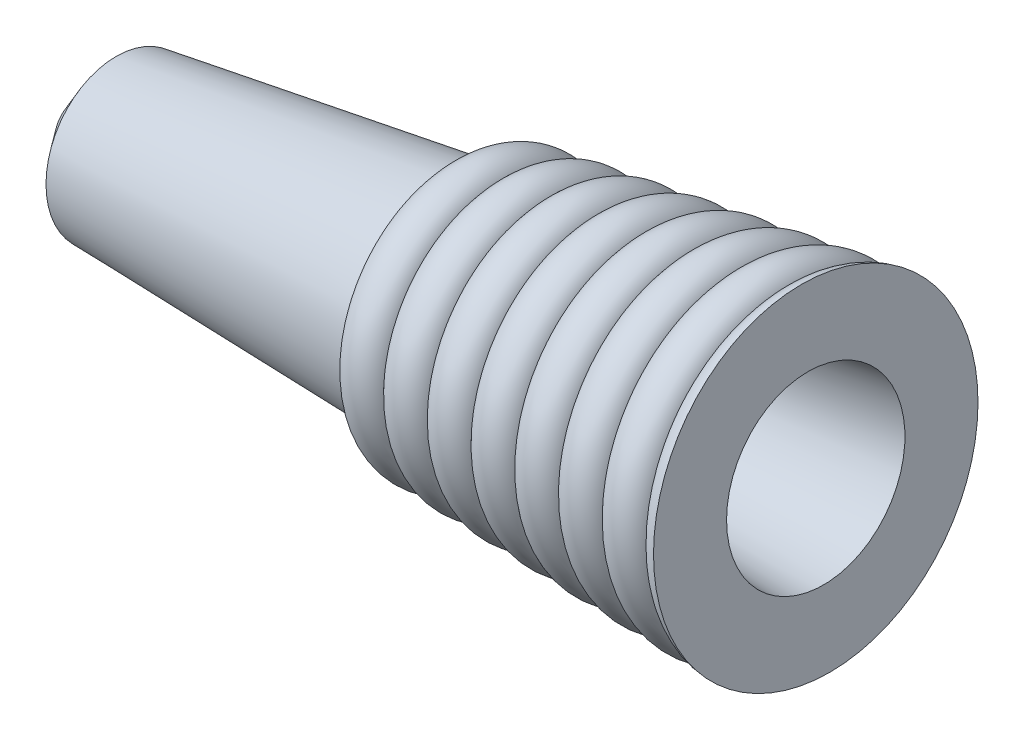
SolidWorks part; units mm, degrees
ref_plane "Front Plane" through (0, 0, 0) normal (0, 0, 1) x (1, 0, 0)
ref_plane "Top Plane" through (0, 0, 0) normal (0, 1, 0) x (1, 0, 0)
ref_plane "Right Plane" through (0, 0, 0) normal (1, 0, 0) x (0, 0, -1)
sketch "Sketch1" plane through (0, 0, 0) normal (0, 0, 1) x (1, 0, 0)
  line L0 (0, 0) -> (97.5367, 0) construction
  line L1 (0, 0) -> (6.35, -6.35)
  line L2 (6.35, -6.35) -> (50.8, -6.35)
  line L4 (292.1, 0) -> (259.4617, 0)
  line L5 (0, 0) -> (0, 25.5554) construction
  line L6 (203.2, -6.35) -> (292.1, -6.35)
  line L7 (145.1617, 12.7) -> (145.1617, 0) construction
  line L8 (0, 6.35) -> (292.1, 6.35) construction
  line L9 (145.1617, 0) -> (151.5117, 6.35)
  line L11 (151.5117, 6.35) -> (154.6867, 6.35)
  line L12 (148.3367, 0) -> (154.6867, 6.35)
  line L13 (-11.1934, -0.9793) -> (308.0638, 26.9521) construction
  line L14 (129.2867, 0) -> (135.6367, 6.35)
  line L16 (132.4617, 0) -> (138.8117, 6.35)
  line L17 (135.6367, 6.35) -> (138.8117, 6.35)
  line L18 (113.4117, 0) -> (119.7617, 6.35)
  line L20 (116.5867, 0) -> (122.9367, 6.35)
  line L21 (119.7617, 6.35) -> (122.9367, 6.35)
  line L22 (97.5367, 0) -> (103.8867, 6.35)
  line L24 (100.7117, 0) -> (107.0617, 6.35)
  line L25 (103.8867, 6.35) -> (107.0617, 6.35)
  line L26 (161.0367, 0) -> (167.3867, 6.35)
  line L28 (164.2117, 0) -> (170.5617, 6.35)
  line L29 (167.3867, 6.35) -> (170.5617, 6.35)
  line L30 (176.9117, 0) -> (183.2617, 6.35)
  line L32 (180.0867, 0) -> (186.4367, 6.35)
  line L33 (183.2617, 6.35) -> (186.4367, 6.35)
  line L34 (192.7867, 0) -> (199.1367, 6.35)
  line L36 (195.9617, 0) -> (202.3117, 6.35)
  line L37 (199.1367, 6.35) -> (202.3117, 6.35)
  line L38 (208.6617, 0) -> (215.0117, 6.35)
  line L40 (211.8367, 0) -> (218.1867, 6.35)
  line L41 (215.0117, 6.35) -> (218.1867, 6.35)
  line L42 (224.5367, 0) -> (230.8867, 6.35)
  line L44 (227.7117, 0) -> (234.0617, 6.35)
  line L45 (230.8867, 6.35) -> (234.0617, 6.35)
  line L46 (240.4117, 0) -> (246.7617, 6.35)
  line L48 (243.5867, 0) -> (249.9367, 6.35)
  line L49 (246.7617, 6.35) -> (249.9367, 6.35)
  line L50 (256.2867, 0) -> (262.6367, 6.35)
  line L52 (259.4617, 0) -> (265.8117, 6.35)
  line L53 (262.6367, 6.35) -> (265.8117, 6.35)
  line L54 (29.792, 5.7936) -> (85.7641, 10.6905) construction
  line L55 (100.7117, 0) -> (113.4117, 0) construction
  line L56 (97.5367, 0) -> (0, 0)
  line L58 (113.4117, 0) -> (100.7117, 0)
  line L59 (116.5867, 0) -> (129.2867, 0) construction
  line L60 (291.396, -1.1111) -> (312.3584, -1.1111) construction
  line L61 (129.2867, 0) -> (116.5867, 0)
  line L62 (132.4617, 0) -> (145.1617, 0) construction
  line L63 (145.1617, 0) -> (132.4617, 0)
  line L64 (148.3367, 0) -> (161.0367, 0) construction
  line L65 (164.2117, 0) -> (176.9117, 0) construction
  line L66 (161.0367, 0) -> (148.3367, 0)
  line L67 (176.9117, 0) -> (164.2117, 0)
  line L68 (180.0867, 0) -> (192.7867, 0) construction
  line L69 (192.7867, 0) -> (180.0867, 0)
  line L70 (195.9617, 0) -> (208.6617, 0) construction
  line L71 (208.6617, 0) -> (195.9617, 0)
  line L72 (211.8367, 0) -> (224.5367, 0) construction
  line L73 (224.5367, 0) -> (211.8367, 0)
  line L74 (227.7117, 0) -> (240.4117, 0) construction
  line L75 (240.4117, 0) -> (227.7117, 0)
  line L76 (243.5867, 0) -> (256.2867, 0) construction
  line L77 (256.2867, 0) -> (243.5867, 0)
  line L78 (259.4617, 0) -> (292.1, 0) construction
  line L79 (292.1, 0) -> (304.8, -1.1111)
  line L81 (292.1, 0) -> (292.1, 25.5554) construction
  line L82 (292.1, -6.35) -> (304.8, -1.1111)
  line L83 (292.1, 0) -> (292.1, -25.2445) construction
  arc A0 (57.15, -6.35) -> (50.8, -6.35) centre (53.975, -6.35) cw
  arc A1 (63.5, -6.35) -> (57.15, -6.35) centre (60.325, -6.35) cw
  arc A2 (69.85, -6.35) -> (63.5, -6.35) centre (66.675, -6.35) cw
  arc A3 (76.2, -6.35) -> (69.85, -6.35) centre (73.025, -6.35) cw
  arc A4 (82.55, -6.35) -> (76.2, -6.35) centre (79.375, -6.35) cw
  arc A5 (88.9, -6.35) -> (82.55, -6.35) centre (85.725, -6.35) cw
  arc A6 (95.25, -6.35) -> (88.9, -6.35) centre (92.075, -6.35) cw
  arc A7 (101.6, -6.35) -> (95.25, -6.35) centre (98.425, -6.35) cw
  arc A8 (107.95, -6.35) -> (101.6, -6.35) centre (104.775, -6.35) cw
  arc A9 (114.3, -6.35) -> (107.95, -6.35) centre (111.125, -6.35) cw
  arc A10 (120.65, -6.35) -> (114.3, -6.35) centre (117.475, -6.35) cw
  arc A11 (127, -6.35) -> (120.65, -6.35) centre (123.825, -6.35) cw
  arc A12 (133.35, -6.35) -> (127, -6.35) centre (130.175, -6.35) cw
  arc A13 (139.7, -6.35) -> (133.35, -6.35) centre (136.525, -6.35) cw
  arc A14 (146.05, -6.35) -> (139.7, -6.35) centre (142.875, -6.35) cw
  arc A15 (152.4, -6.35) -> (146.05, -6.35) centre (149.225, -6.35) cw
  arc A16 (158.75, -6.35) -> (152.4, -6.35) centre (155.575, -6.35) cw
  arc A17 (165.1, -6.35) -> (158.75, -6.35) centre (161.925, -6.35) cw
  arc A18 (171.45, -6.35) -> (165.1, -6.35) centre (168.275, -6.35) cw
  arc A19 (177.8, -6.35) -> (171.45, -6.35) centre (174.625, -6.35) cw
  arc A20 (184.15, -6.35) -> (177.8, -6.35) centre (180.975, -6.35) cw
  arc A21 (190.5, -6.35) -> (184.15, -6.35) centre (187.325, -6.35) cw
  arc A22 (196.85, -6.35) -> (190.5, -6.35) centre (193.675, -6.35) cw
  arc A23 (203.2, -6.35) -> (196.85, -6.35) centre (200.025, -6.35) cw
  point P29 (145.1617, 6.35)
  dimension "D12" = 3.175
  dimension "D1" = 292.1
  dimension "D2" = 45
  dimension "D3" = 6.35
  dimension "D4" = 4
  dimension "D5" = 3.175
  dimension "D6" = 3.175
  dimension "D7" = 5
  dimension "D8" = 12.7
  dimension "D10" = 12.7
  dimension "D11" = 50.8
  dimension "D14" = 6.35
  dimension "D15" = 45
  dimension "D16" = 175
  dimension "D17" = 12.7
  dimension "D9" = 8
  dimension "D13" = 24
revolve "Revolve2" add sketch "Sketch1" angle 360 about L54
ref_plane "Plane1" through (96.7958, 8.4685, 0) normal (0.9962, 0.0872, 0) x (0, 0, -1)
other "SurfaceCut3"
